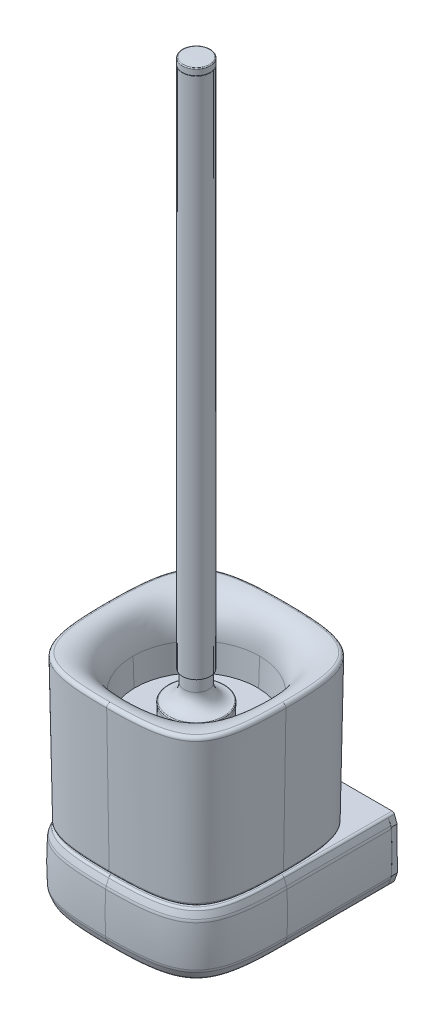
SolidWorks part; units mm, degrees
ref_plane "Piano frontale" through (0, 0, 0) normal (0, 0, 1) x (1, 0, 0)
ref_plane "Piano superiore" through (0, 0, 0) normal (0, 1, 0) x (1, 0, 0)
ref_plane "Piano destro" through (0, 0, 0) normal (1, 0, 0) x (0, 0, -1)
imported_body "Importato1"
imported_body "Importato2"
imported_body "Importato3"
imported_body "Importato4"
imported_body "Importato5"
imported_body "Importato6"
imported_body "Importato7"
ref_plane "Piano2" through (0, 0, -59.8) normal (0, 0, -1) x (-1, 0, 0)
sketch "Schizzo3" plane through (0, 0, -59.8) normal (0, 0, -1) x (-1, 0, 0)
  line L1 (-49.0083, 35) -> (49.0083, 35) construction
  line L2 (-49.0083, 35) -> (49.0083, 35)
  line L3 (50.3914, 34.0806) -> (51.9447, 29.9933)
  line L4 (51.9447, 29.9933) -> (52.0459, 5.7554)
  line L5 (52.0459, 5.7554) -> (50.3914, 0.9194)
  line L6 (49.0083, 0) -> (-49.0083, 0)
  line L7 (-50.3914, 34.0806) -> (-51.9447, 29.9933)
  line L8 (-51.9447, 29.9933) -> (-52.0459, 5.7554)
  line L9 (-52.0459, 5.7554) -> (-50.3914, 0.9194)
  arc A0 (-49.0083, 35) -> (-50.3914, 34.0806) centre (-49.0083, 33.5) ccw construction
  arc A14 (52.0459, 29.2446) -> (51.7318, 30.7182) centre (47.0545, 28.951) ccw construction
  arc A15 (50.3914, 0.9194) -> (49.0083, 0) centre (49.0083, 1.5) cw
  arc A16 (49.0083, 0) -> (50.3914, 0.9194) centre (49.0083, 1.5) ccw construction
  arc A17 (-49.0083, 0) -> (-50.3914, 0.9194) centre (-49.0083, 1.5) cw
  arc A18 (-50.3914, 0.9194) -> (-49.0083, 0) centre (-49.0083, 1.5) ccw construction
  arc A19 (-49.0083, 35) -> (-50.3914, 34.0806) centre (-49.0083, 33.5) ccw
  arc A20 (-51.7318, 30.7182) -> (-52.0459, 29.2446) centre (-47.0545, 28.951) ccw construction
  arc A21 (49.0083, 35) -> (50.3914, 34.0806) centre (49.0083, 33.5) cw
extrude "Estrusione-Estrusione1" add sketch "Schizzo3" along normal blind 3.5
